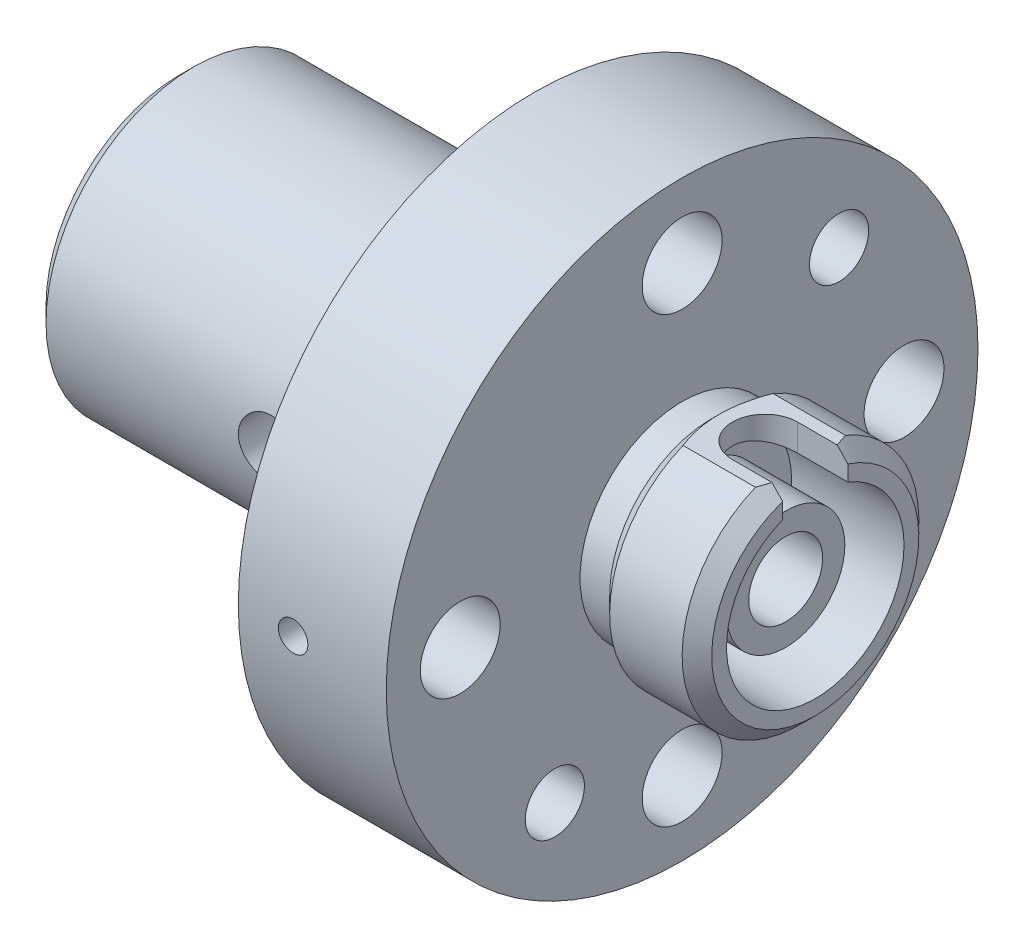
SolidWorks part; units mm, degrees
ref_plane "Vorne" through (0, 0, 0) normal (0, 0, 1) x (1, 0, 0)
ref_plane "Oben" through (0, 0, 0) normal (0, 1, 0) x (1, 0, 0)
ref_plane "Rechts" through (0, 0, 0) normal (1, 0, 0) x (0, 0, -1)
sketch "Skizze1" plane through (0, 0, 0) normal (0, 0, 1) x (1, 0, 0)
  line L0 (0, 0) -> (-9.1862, 0) construction
  line L1 (-12, 1.25) -> (8.5, 1.25)
  line L2 (8.5, 1.25) -> (8.5, 2)
  line L3 (8.5, 2) -> (5.7, 2)
  line L4 (5.7, 2) -> (5.7, 3)
  line L5 (5.7, 3) -> (9.5, 3)
  line L6 (9.5, 3) -> (9.5, 3.5)
  line L7 (9, 4) -> (6.55, 4)
  line L8 (5, 3.45) -> (5, 10)
  line L9 (5, 10) -> (3, 10)
  line L11 (3, 10) -> (0, 10)
  line L12 (0, 10) -> (0, 5)
  line L13 (0, 5) -> (-12, 5)
  line L14 (-12, 5) -> (-12, 1.25)
  line L15 (5, 3.45) -> (6, 3.45)
  line L16 (6, 3.45) -> (6.55, 4)
  line L17 (9.5, 3.5) -> (9, 4)
  dimension "D1" = 2.5
  dimension "D2" = 4
  dimension "D3" = 6
  dimension "D4" = 8
  dimension "D5" = 10
  dimension "D6" = 20
  dimension "D7" = 12
  dimension "D9" = 1
  dimension "D10" = 3.8
  dimension "D11" = 4.5
  dimension "D12" = 21.5
  dimension "D13" = 6.9
  dimension "D14" = 1
  dimension "D15" = 45
  dimension "D16" = 0.5
  dimension "D17" = 45
revolve "Rotation1" add sketch "Skizze1" angle 360 about L0
sketch "Skizze2" plane through (0, 0, 0) normal (0, 0, 1) x (1, 0, 0)
  line L0 (5, -10) -> (5, 10) construction
  line L1 (5, 3.7) -> (9.5, 3.7)
  line L2 (5, 3.7) -> (5, 4.5)
  line L3 (5, 4.5) -> (9.5, 4.5)
  line L4 (9.5, 3.7) -> (9.5, 4.5)
  line L5 (-12, 0) -> (8.5, 0) construction
  line L6 (9.5, -3.5) -> (9.5, 3.5) construction
  dimension "D1" = 3.7
  dimension "D2" = 4.5
extrude "Linear austragen1" cut sketch "Skizze2" against normal through all and the other way through all
sketch "Skizze3" plane through (0, 3.7, 0) normal (0, 1, 0) x (1, 0, 0)
  line L0 (-12, 0) -> (8.5, 0) construction
  line L1 (9.5, -3.5) -> (9.5, 3.5) construction
  line L2 (9.5, -1.1) -> (9.5, 1.1)
  line L3 (7.8, 1.1) -> (9.5, 1.1)
  line L4 (7.8, -1.1) -> (9.5, -1.1)
  arc A0 (7.8, 1.1) -> (7.8, -1.1) centre (7.8, 0) ccw
  dimension "D1" = 2.8
  dimension "D2" = 1.1
extrude "Linear austragen2" cut sketch "Skizze3" against normal up to next
hole_wizard "Ø2.7 (2.7) Durchmesser Bohrung1" positions "Skizze5" profile "Skizze4" hole size "Ø2.7" standard "ISO"
sketch "Skizze5" plane through (5, -0.0264, -0.1545) normal (1, 0, 0) x (0, 0, -1)
  point P0 (-0.1545, 7.5264)
  dimension "D1" = 7.5
sketch "Skizze4" plane through (5, 7.5, 0) normal (0, 1, 0) x (0, 0, -1)
  line L0 (0, 0) -> (0, 5.001)
  line L1 (0, 5.001) -> (1.35, 5.001)
  line L2 (1.35, 5.001) -> (1.35, 0)
  line L5 (1.35, 0) -> (0, 0)
  line L11 (0, -6.35) -> (0, 107.95) construction
  dimension "Bohrerdurchmesser" = 2.7
  dimension "Bohrungstiefe" = 5.001
pattern_circular "Kreismuster1" count 4 over 360 about axis through (0, 0, 0) along (1, 0, 0) of "Ø2.7 (2.7) Durchmesser Bohrung1"
sketch "Skizze6" plane through (5, 0, 0) normal (1, 0, 0) x (0, 0, -1)
  line L0 (0, 0) -> (5.3033, 5.3033) construction
  line L1 (0, 0) -> (-7.5, 0) construction
  line L2 (0, 0) -> (0, -7.5) construction
  line L3 (0, 0) -> (-4.3018, -6.1436) construction
  circle A0 centre (0, 0) radius 7.5 construction
  circle A1 centre (5.3033, 5.3033) radius 1
  circle A2 centre (-4.3018, -6.1436) radius 1
  dimension "D3" = 2
  dimension "D4" = 2
  dimension "D1" = 35
  dimension "D2" = 45
extrude "Linear austragen3" cut sketch "Skizze6" against normal up to next
sketch "Skizze7" plane through (0, 0, 0) normal (0, 0, 1) x (1, 0, 0)
  line L0 (-12, 5) -> (-12, -5) construction
  line L1 (-12, 2) -> (-8, 2)
  line L2 (-12, 2) -> (-12, 0)
  line L3 (-12, 0) -> (-8, 0)
  line L4 (-8, 2) -> (-8, 0)
  line L5 (-12, 0) -> (8.5, 0) construction
  dimension "D1" = 2
  dimension "D2" = 4
revolve "Schnitt-Rotation1" cut sketch "Skizze7" angle 360 about L3
sketch "Skizze8" plane through (0, 0, 0) normal (0, 0, 1) x (1, 0, 0)
  line L0 (-8, 0) -> (8.5, 0) construction
  line L1 (-12, 2) -> (-12, -2) construction
  circle A0 centre (-4, 0) radius 1
  dimension "D1" = 2
  dimension "D2" = 8
extrude "Linear austragen4" cut sketch "Skizze8" against normal mid plane 35
chamfer "Fase1" distance 0.5 angle 45 1 edges at (-12, 0, -5)
sketch "Skizze9" plane through (0, 0, 0) normal (0, 0, 1) x (1, 0, 0)
  line L0 (-8, 0) -> (8.5, 0) construction
  line L1 (9.5, -3.5) -> (9.5, 3.3226) construction
  circle A0 centre (1.85, 0) radius 0.5
  dimension "D1" = 1
  dimension "D2" = 7.65
extrude "Linear austragen5" cut sketch "Skizze9" against normal mid plane 83
